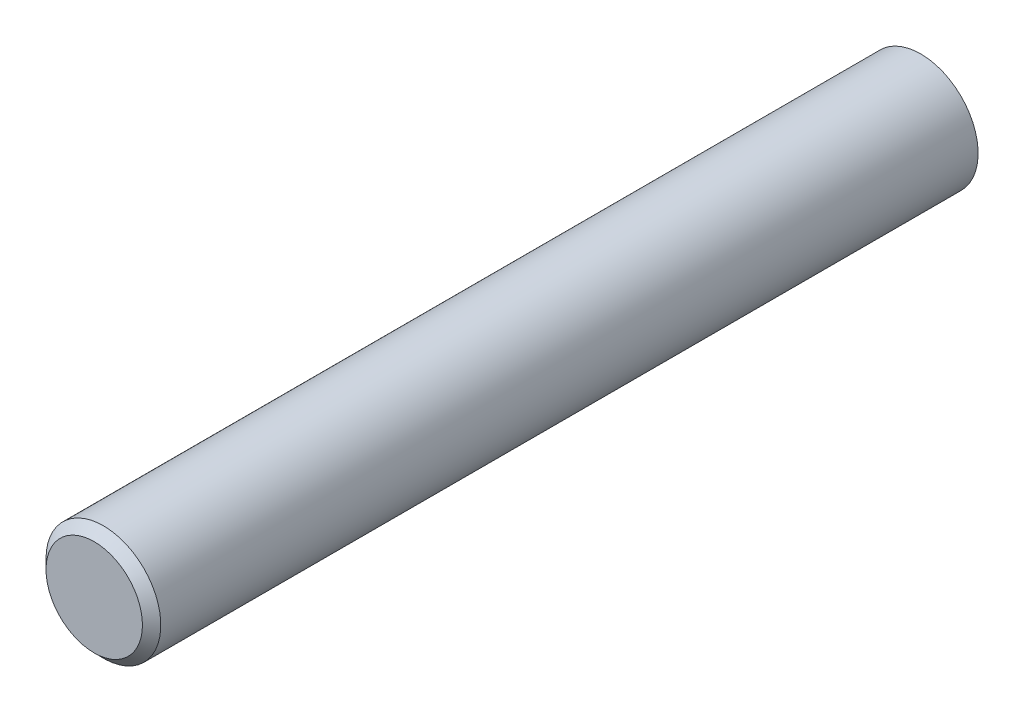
SolidWorks part; units mm, degrees
ref_plane "前视基准面" through (0, 0, 0) normal (0, 0, 1) x (1, 0, 0)
ref_plane "上视基准面" through (0, 0, 0) normal (0, 1, 0) x (1, 0, 0)
ref_plane "右视基准面" through (0, 0, 0) normal (1, 0, 0) x (0, 0, -1)
sketch "草图1" plane through (0, 0, 0) normal (0, 0, 1) x (1, 0, 0)
  circle A0 centre (0, 0) radius 12.5
extrude "凸台-拉伸1" add sketch "草图1" along normal blind 180
chamfer "倒角1" distance 2 angle 45 1 edges at (12.5, 0, 180)
sketch "草图2" plane through (0, 0, 0) normal (0, 0, -1) x (-1, 0, 0)
  circle A0 centre (0, 0) radius 4
extrude "切除-拉伸1" cut sketch "草图2" against normal blind 15
